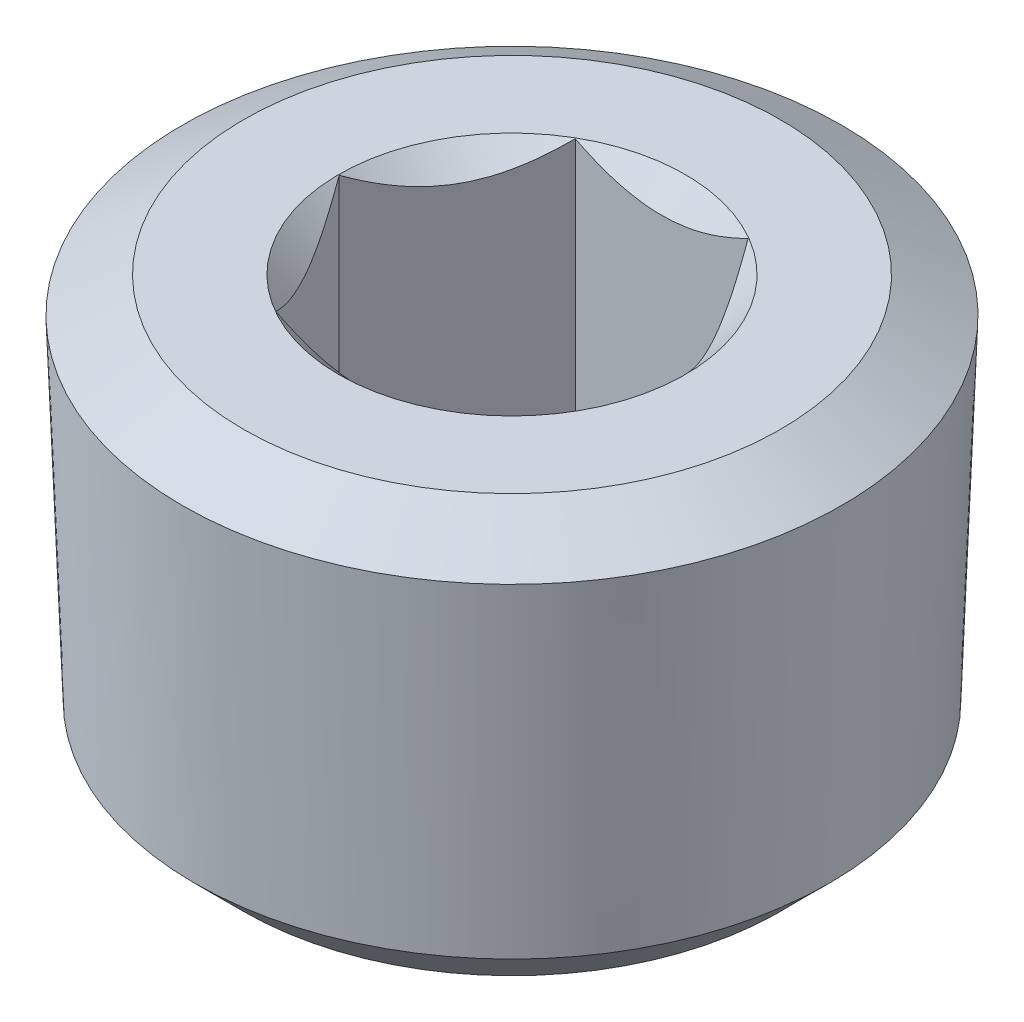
SolidWorks part; units mm, degrees
ref_plane "Front Plane" through (0, 0, 0) normal (0, 0, 1) x (1, 0, 0)
ref_plane "Top Plane" through (0, 0, 0) normal (0, 1, 0) x (1, 0, 0)
ref_plane "Right Plane" through (0, 0, 0) normal (1, 0, 0) x (0, 0, -1)
sketch "Sketch2" plane through (0, 0, 0) normal (0, 0, 1) x (1, 0, 0)
  line L0 (0, 10.7443) -> (0, -17.0657) construction
  line L1 (0, 0) -> (-8.6532, 0)
  line L2 (-10.6265, -1.1393) -> (-10.2349, -11.8803)
  line L3 (-8.6532, -13.462) -> (0, -13.462)
  line L4 (0, -13.462) -> (0, 0)
  line L6 (-8.6532, -13.462) -> (-10.2349, -11.8803)
  line L7 (-8.6532, 0) -> (-10.6265, -1.1393)
  point P4 (-10.668, 0)
  point P6 (-10.1772, -13.462)
  dimension "D1" = 13.462
  dimension "D2" = 2.088
  dimension "D3" = 21.336
  dimension "D4" = 30
  dimension "D5" = 1.524
  dimension "D6" = 45
revolve "Revolve1" add sketch "Sketch2" angle 360 about L0
sketch "Sketch3" plane through (0, 0, 0) normal (0, 0, 1) x (1, 0, 0)
  line L0 (0, 2.9342) -> (0, -8.1202) construction
  line L1 (0, 0) -> (-5.588, 0)
  line L2 (8.6532, 0) -> (-8.6532, 0) construction
  line L3 (-4.826, -0.762) -> (-4.826, -8.89)
  line L4 (-4.826, -8.89) -> (-2.7124, -10.16)
  line L5 (0, -10.16) -> (0, 0)
  line L6 (-4.826, -0.762) -> (-5.588, 0)
  line L7 (-2.7124, -10.16) -> (0, -10.16)
  dimension "D1" = 8.89
  dimension "D2" = 59
  dimension "D3" = 9.652
  dimension "D4" = 0.762
  dimension "D5" = 45
  dimension "D6" = 10.16
revolve "Cut-Revolve1" cut sketch "Sketch3" angle 360 about L0
sketch "Sketch4" plane through (0, 0, 0) normal (0, 1, 0) x (1, 0, 0)
  line L1 (-2.7863, -4.826) -> (2.7863, -4.826)
  line L2 (2.7863, -4.826) -> (5.5726, 0)
  line L3 (5.5726, 0) -> (2.7863, 4.826)
  line L4 (2.7863, 4.826) -> (-2.7863, 4.826)
  line L5 (-2.7863, 4.826) -> (-5.5726, 0)
  line L6 (-5.5726, 0) -> (-2.7863, -4.826)
  circle A0 centre (0, 0) radius 4.826 construction
  circle A1 centre (0, 0) radius 4.826 construction
extrude "Cut-Extrude1" cut sketch "Sketch4" against normal up to vertex (5.2929 mm away)
